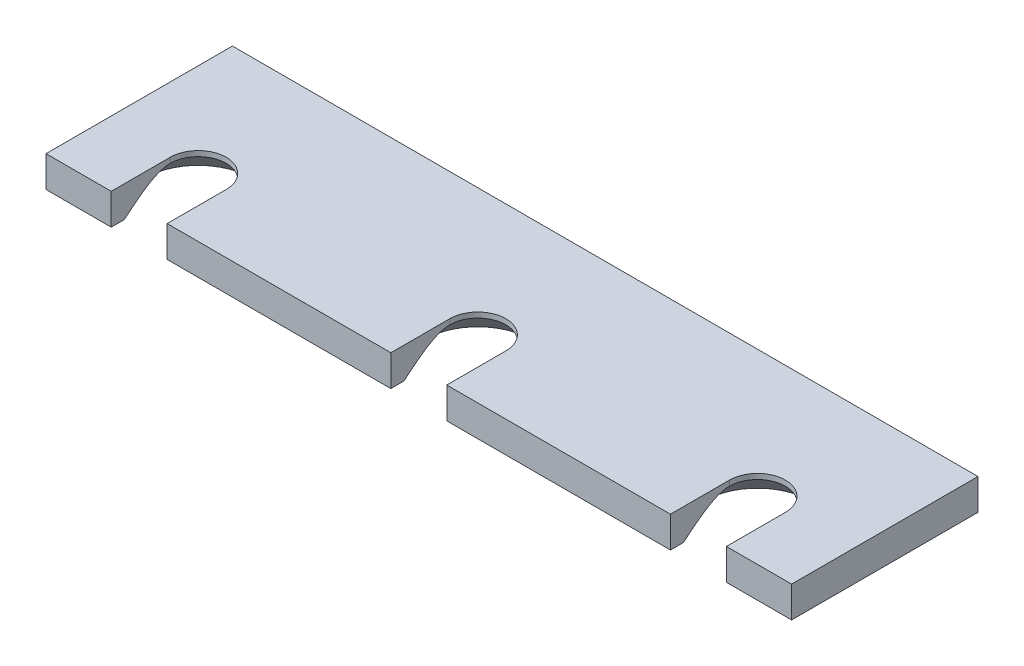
SolidWorks part; units mm, degrees
ref_plane "Front" through (0, 0, 0) normal (0, 0, 1) x (1, 0, 0)
ref_plane "Top" through (0, 0, 0) normal (0, 1, 0) x (1, 0, 0)
ref_plane "Right" through (0, 0, 0) normal (1, 0, 0) x (0, 0, -1)
imported_body "Imported1"
sketch "Sketch1" plane through (0, -5, 0) normal (0, -1, 0) x (1, 0, 0)
  arc A0 (10.5, 26.5) -> (19.5, 26.5) centre (15, 20.5) ccw construction
  arc A1 (10.5, 26.5) -> (19.5, 26.5) centre (15, 20.5) ccw
  arc A2 (100.5, 26.5) -> (109.5, 26.5) centre (105, 20.5) ccw construction
  arc A3 (100.5, 26.5) -> (109.5, 26.5) centre (105, 20.5) ccw
  arc A4 (55.5, 26.5) -> (64.5, 26.5) centre (60, 20.5) ccw construction
  arc A5 (55.5, 26.5) -> (64.5, 26.5) centre (60, 20.5) ccw
hole_wizard "CSK for M8 Flat Head Machine Screw1" positions "3DSketch1" profile "Sketch2" countersink size "M8" standard "Ansi Metric"
sketch3d "3DSketch1"
  point P0 (105, -5, 20.5)
  point P3 (60, -5, 20.5)
  point P6 (15, -5, 20.5)
sketch "Sketch2" plane through (105, -5, 20.5) normal (1, 0, 0) x (0, 0, -1)
  line L0 (0, 0) -> (0, 5)
  line L1 (0, 5) -> (4.5, 5)
  line L2 (4.5, 5) -> (4.5, 4.15)
  line L3 (4.5, 4.15) -> (8.65, 0)
  line L5 (8.65, 0) -> (0, 0)
  line L6 (-4.5, 4.15) -> (-8.65, 0) construction
  line L11 (0, -6.35) -> (0, 107.95) construction
  dimension "Thru Hole Dia." = 9
  dimension "Thru Hole Depth" = 5
  dimension "Near C'Sink Dia." = 17.3
  dimension "Near C'Sink Angle" = 90
